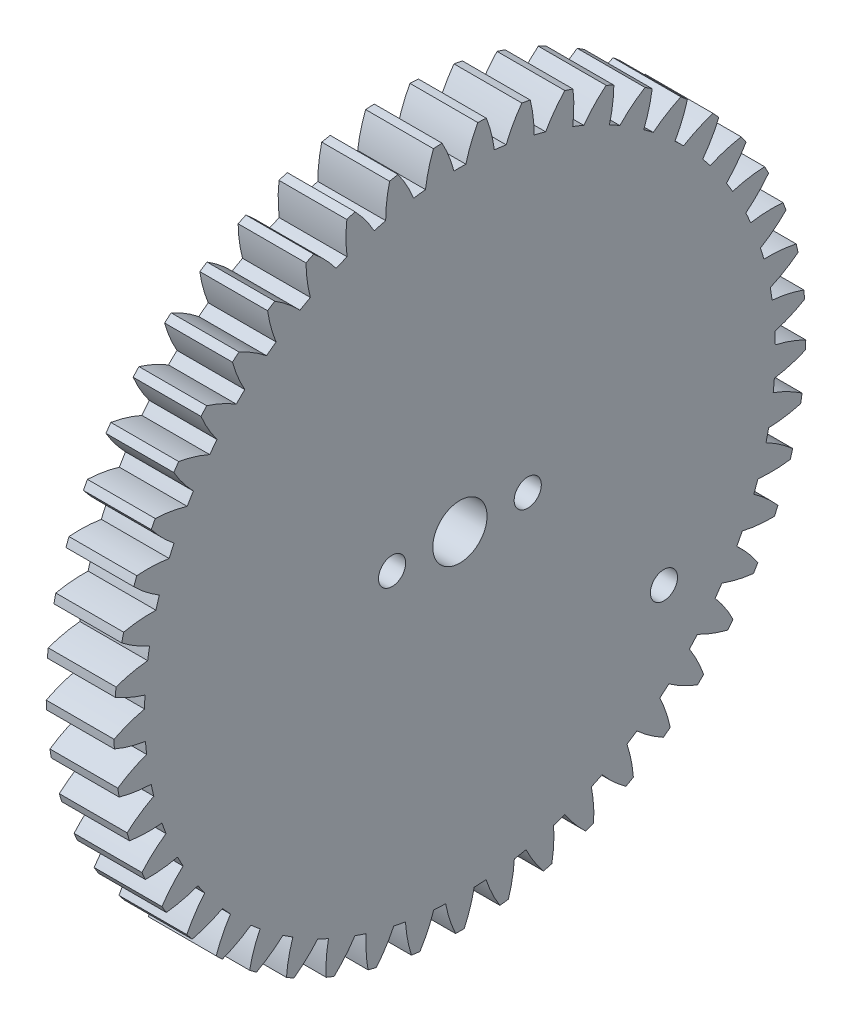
SolidWorks part; units mm, degrees
ref_plane "Front Plane" through (0, 0, 0) normal (0, 0, 1) x (1, 0, 0)
ref_plane "Top Plane" through (0, 0, 0) normal (0, 1, 0) x (1, 0, 0)
ref_plane "Right Plane" through (0, 0, 0) normal (1, 0, 0) x (0, 0, -1)
inserted part "spur gear_am<3>@tmpAssm"
sketch "Sketch1" plane through (-5.7393, 0, 0) normal (1, 0, 0) x (0, 0, -1)
  line L0 (56.4884, -29.4442) -> (79.1739, -29.4442) construction
  line L1 (56.4884, -29.4442) -> (69.6314, -38.9919) construction
  line L2 (56.4884, -29.4442) -> (41.6684, -29.4442) construction
  circle A0 centre (71.5289, -40.3704) radius 1
  circle A1 centre (56.4884, -29.4442) radius 2 construction
  circle A2 centre (61.4884, -29.4442) radius 1
  circle A3 centre (51.4884, -29.4442) radius 1
  dimension "D2" = 18.5902
  dimension "D3" = 5
  dimension "D4" = 5
  dimension "D1" = 324.003
extrude "Cut-Extrude1" cut sketch "Sketch1" against normal blind 5
sketch "Sketch2" plane through (-5.7393, 0, 0) normal (1, 0, 0) x (0, 0, -1)
  line L0 (52.4884, -29.4442) -> (60.4884, -29.4442)
  circle A0 centre (51.4884, -29.4442) radius 1 construction
  circle A1 centre (61.4884, -29.4442) radius 1 construction
